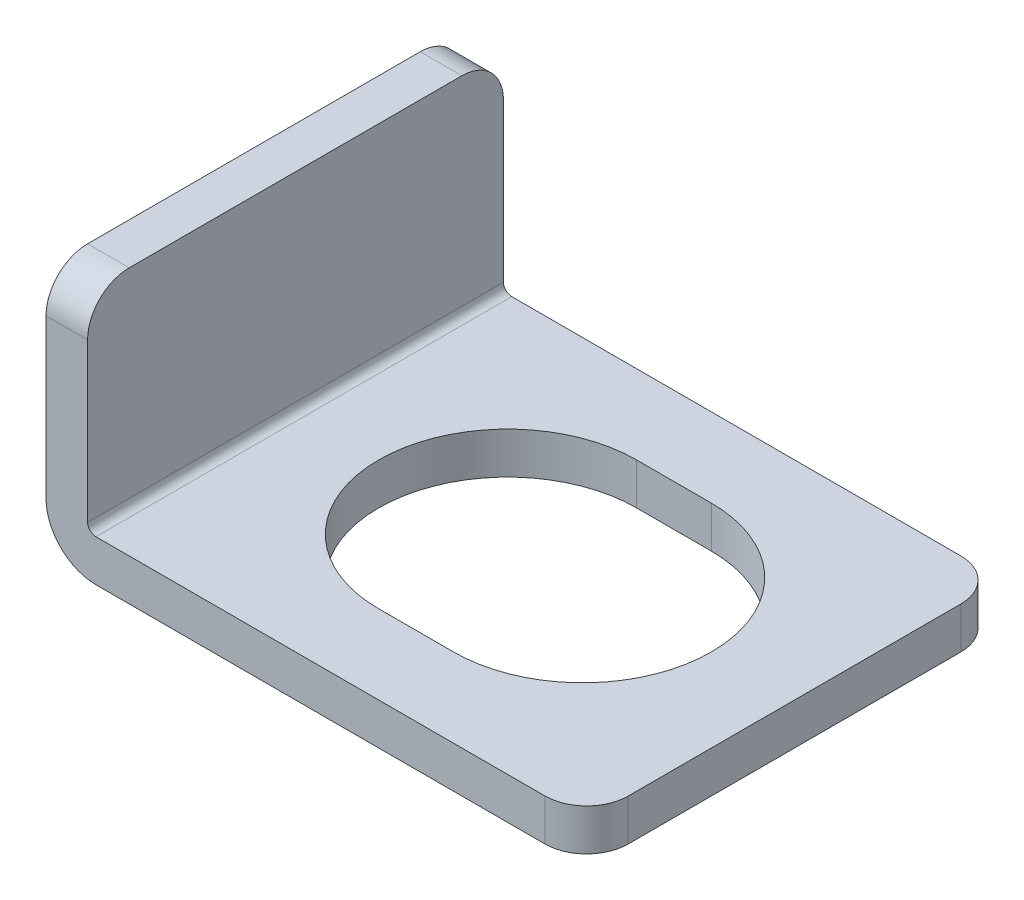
SolidWorks part; units mm, degrees
ref_plane "Front Plane" through (0, 0, 0) normal (0, 0, 1) x (1, 0, 0)
ref_plane "Top Plane" through (0, 0, 0) normal (0, 1, 0) x (1, 0, 0)
ref_plane "Right Plane" through (0, 0, 0) normal (1, 0, 0) x (0, 0, -1)
sketch "Sketch1" plane through (0, 0, 0) normal (0, 0, 1) x (1, 0, 0)
  line L0 (0, 1.2) -> (0, 6)
  line L1 (1.2, 0) -> (13, 0)
  line L2 (1.2, 1) -> (13, 1)
  line L3 (1, 1.2) -> (1, 6)
  line L4 (13, 1) -> (13, 0)
  line L5 (0, 6) -> (1, 6)
  arc A0 (1.2, 0) -> (0, 1.2) centre (1.2, 1.2) cw
  arc A1 (1.2, 1) -> (1, 1.2) centre (1.2, 1.2) cw
  point P6 (0, 0)
  dimension "D3" = 1.2
  dimension "D1" = 6
  dimension "D2" = 13
  dimension "D4" = 1
extrude "Boss-Extrude1" add sketch "Sketch1" along normal mid plane 10
sketch "Sketch2" plane through (0, 1, 0) normal (0, 1, 0) x (1, 0, 0)
  line L0 (6.1, 0) -> (7.9, 0) construction
  line L1 (6.1, 3.1) -> (7.9, 3.1)
  line L2 (6.1, -3.1) -> (7.9, -3.1)
  arc A0 (6.1, 3.1) -> (6.1, -3.1) centre (6.1, 0) ccw
  arc A1 (7.9, -3.1) -> (7.9, 3.1) centre (7.9, 0) ccw
  point P2 (7, 0)
  dimension "D1" = 7
  dimension "D2" = 6.2
  dimension "D3" = 1.8
extrude "Cut-Extrude1" cut sketch "Sketch2" against normal through all
fillet "Fillet1" radius 1 4 edges at (0.5, 6, -5) (13, 0.5, -5) (13, 0.5, 5) (0.5, 6, 5)
